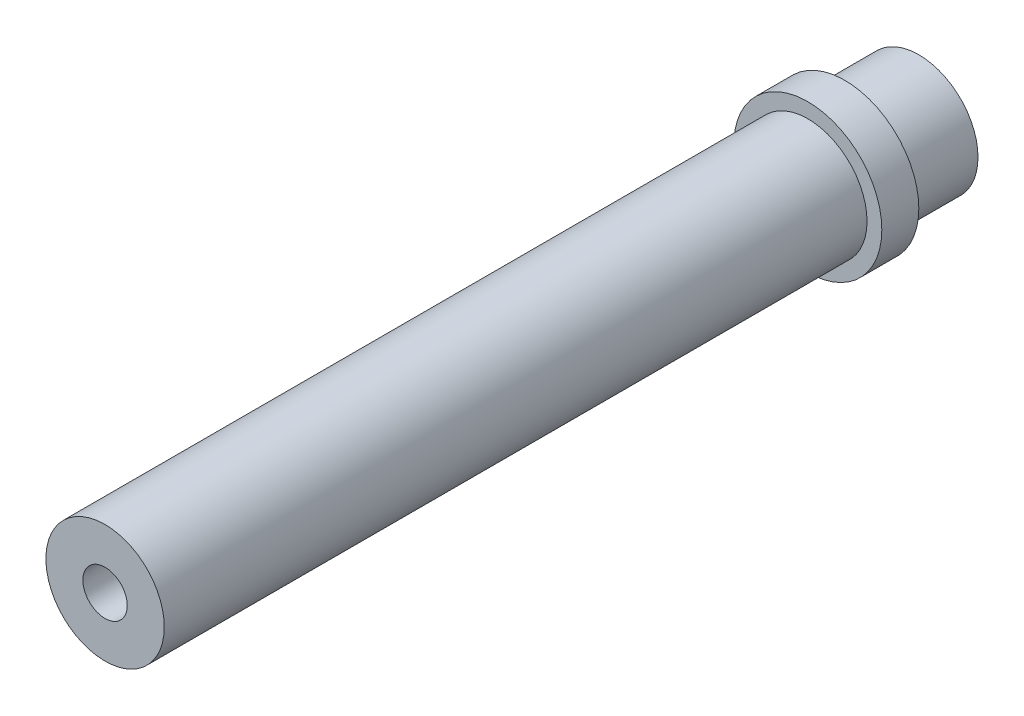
SolidWorks part; units mm, degrees
ref_plane "前视基准面" through (0, 0, 0) normal (0, 0, 1) x (1, 0, 0)
ref_plane "上视基准面" through (0, 0, 0) normal (0, 1, 0) x (1, 0, 0)
ref_plane "右视基准面" through (0, 0, 0) normal (1, 0, 0) x (0, 0, -1)
sketch "草图1" plane through (0, 0, 0) normal (0, 0, 1) x (1, 0, 0)
  circle A0 centre (0, 0) radius 8
extrude "凸台-拉伸1" add sketch "草图1" along normal blind 110
ref_plane "基准面1" through (0, 0, 10) normal (0, 0, 1) x (1, 0, 0)
sketch "草图2" plane through (0, 0, 10) normal (0, 0, 1) x (1, 0, 0)
  circle A0 centre (0, 0) radius 10
extrude "凸台-拉伸2" add sketch "草图2" along normal blind 5
sketch "草图3" plane through (0, 0, 0) normal (0, 0, -1) x (-1, 0, 0)
  circle A0 centre (0, 0) radius 3
extrude "切除-拉伸1" cut sketch "草图3" against normal blind 15
sketch "草图4" plane through (0, 0, 110) normal (0, 0, 1) x (1, 0, 0)
  circle A0 centre (0, 0) radius 3
extrude "切除-拉伸2" cut sketch "草图4" against normal blind 15
